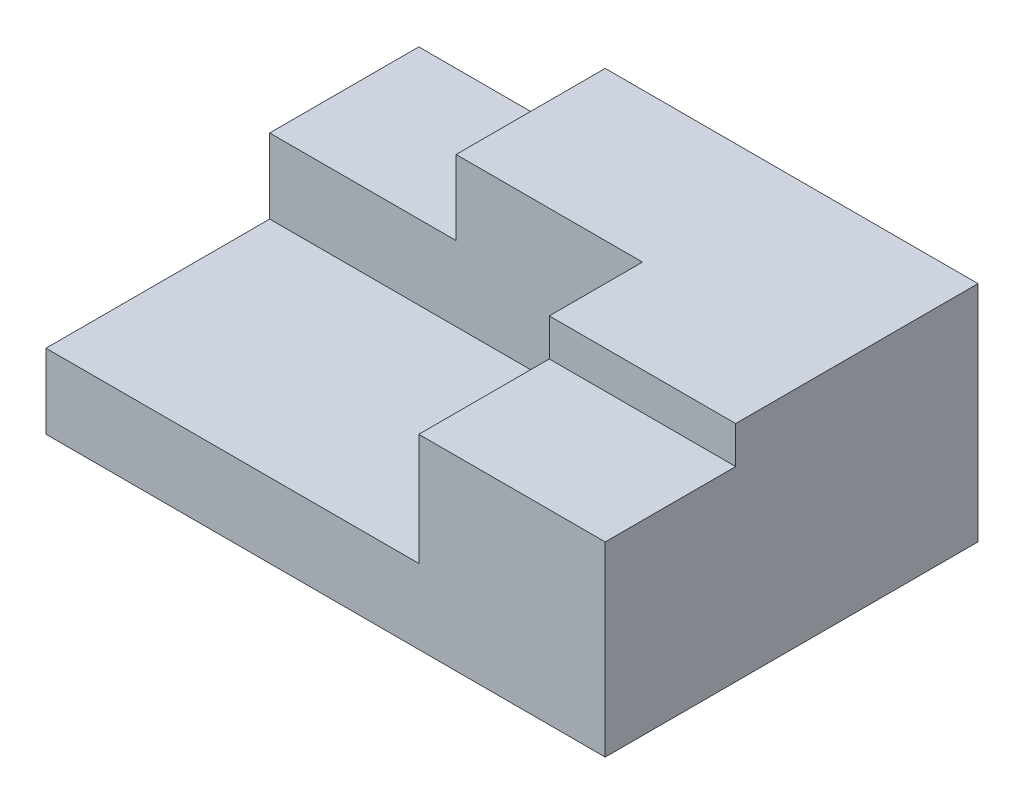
SolidWorks part; units mm, degrees
ref_plane "Ebene vorne" through (0, 0, 0) normal (0, 0, 1) x (1, 0, 0)
ref_plane "Ebene oben" through (0, 0, 0) normal (0, 1, 0) x (1, 0, 0)
ref_plane "Ebene rechts" through (0, 0, 0) normal (1, 0, 0) x (0, 0, -1)
sketch "Skizze1" plane through (0, 0, 0) normal (0, 1, 0) x (1, 0, 0)
  line L1 (0, 0) -> (150, 0)
  line L2 (0, 0) -> (0, 100)
  line L3 (0, 100) -> (150, 100)
  line L4 (150, 0) -> (150, 100)
  dimension "D1" = 150
  dimension "D2" = 100
extrude "Aufsatz-Linear austragen1" add sketch "Skizze1" along normal blind 60
sketch "Skizze2" plane through (0, 60, 0) normal (0, 1, 0) x (1, 0, 0)
  line L1 (0, 0) -> (100, 0)
  line L2 (0, 0) -> (0, 60)
  line L3 (0, 60) -> (100, 60)
  line L4 (100, 0) -> (100, 60)
  dimension "D1" = 100
  dimension "D2" = 60
extrude "Schnitt-Linear austragen1" cut sketch "Skizze2" against normal blind 40
sketch "Skizze4" plane through (0, 60, 0) normal (0, 1, 0) x (1, 0, 0)
  line L0 (100, 60) -> (0, 60) construction
  line L1 (0, 100) -> (50, 100)
  line L2 (0, 100) -> (0, 60)
  line L3 (0, 60) -> (50, 60)
  line L4 (50, 100) -> (50, 60)
  dimension "D1" = 50
extrude "Schnitt-Linear austragen3" cut sketch "Skizze4" against normal blind 20
sketch "Skizze5" plane through (0, 60, 0) normal (0, 1, 0) x (1, 0, 0)
  line L0 (100, 0) -> (100, 60) construction
  line L1 (100, 0) -> (150, 0)
  line L2 (100, 0) -> (100, 35)
  line L3 (100, 35) -> (150, 35)
  line L4 (150, 0) -> (150, 35)
  line L5 (100, 0) -> (150, 0) construction
  line L6 (150, 0) -> (150, 100) construction
  dimension "D1" = 35
extrude "Schnitt-Linear austragen4" cut sketch "Skizze5" against normal blind 10
